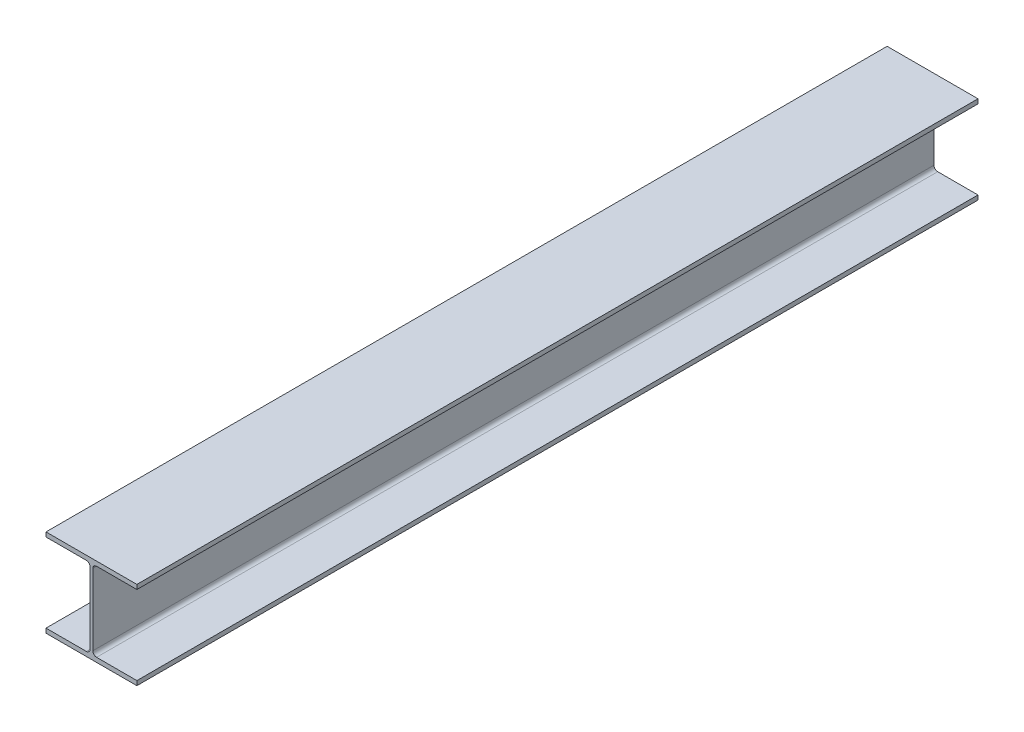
SolidWorks part; units mm, degrees
ref_plane "Front Plane" through (0, 0, 0) normal (0, 0, 1) x (1, 0, 0)
ref_plane "Top Plane" through (0, 0, 0) normal (0, 1, 0) x (1, 0, 0)
ref_plane "Right Plane" through (0, 0, 0) normal (1, 0, 0) x (0, 0, -1)
sketch "sk W14x283" plane through (0, 0, 0) normal (0, 0, 1) x (1, 0, 0)
  line B0 (-184.404, -178.054) -> (-184.404, -160.02)
  line B1 (-184.404, -160.02) -> (-20.828, -160.02)
  line B2 (-5.588, -144.78) -> (-5.588, 144.78)
  line B3 (-20.828, 160.02) -> (-184.404, 160.02)
  line B4 (-184.404, 160.02) -> (-184.404, 178.054)
  line B5 (-184.404, 178.054) -> (184.404, 178.054)
  line B6 (184.404, 178.054) -> (184.404, 160.02)
  line B7 (184.404, 160.02) -> (20.828, 160.02)
  line B8 (5.588, 144.78) -> (5.588, -144.78)
  line B9 (20.828, -160.02) -> (184.404, -160.02)
  line B10 (184.404, -160.02) -> (184.404, -178.054)
  line B11 (184.404, -178.054) -> (-184.404, -178.054)
  line B12 (0, -178.054) -> (0, 178.054) construction
  arc B13 (-20.828, -160.02) -> (-5.588, -144.78) centre (-20.828, -144.78) ccw
  arc B14 (-5.588, 144.78) -> (-20.828, 160.02) centre (-20.828, 144.78) ccw
  arc B15 (20.828, 160.02) -> (5.588, 144.78) centre (20.828, 144.78) ccw
  arc B16 (5.588, -144.78) -> (20.828, -160.02) centre (20.828, -144.78) ccw
sketch_block_instance "w14x90-1"
sketch_block "w14x90"
extrude "Boss-Extrude1" add sketch "sk W14x283" along normal blind 3413.125
